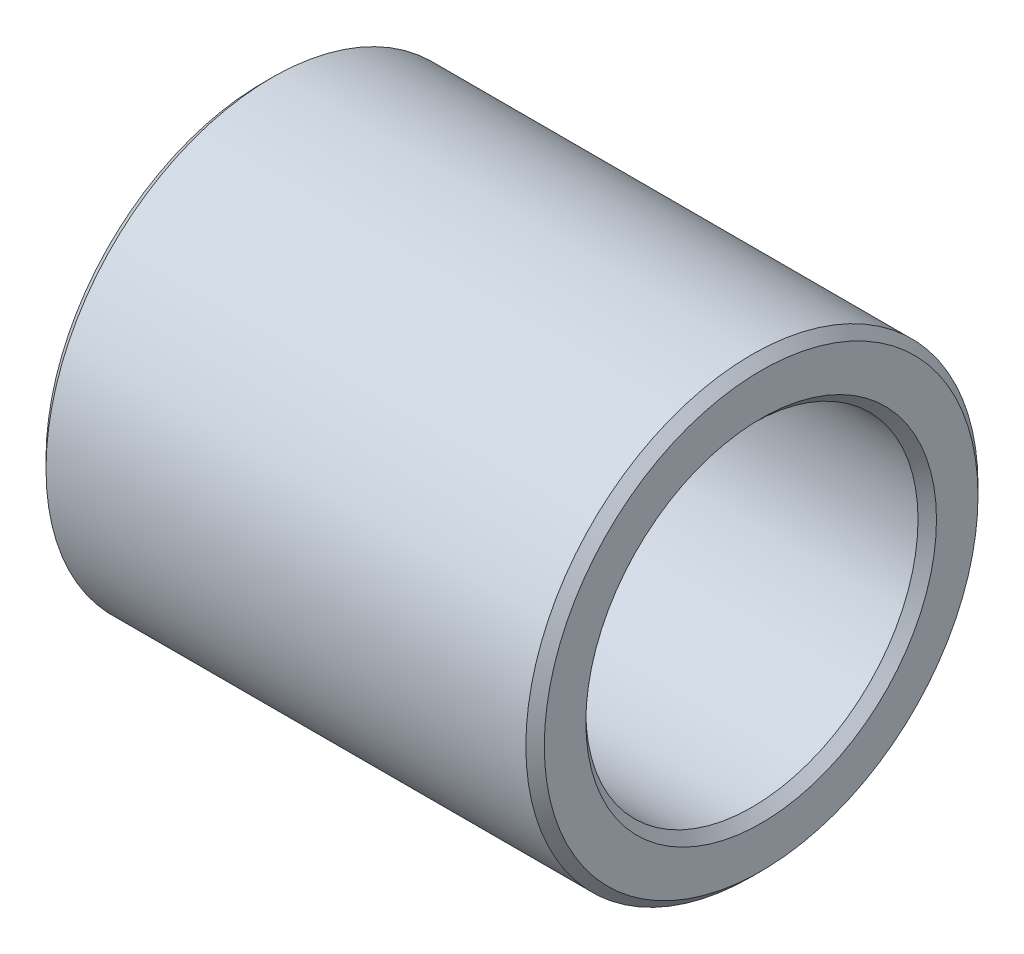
SolidWorks part; units mm, degrees
ref_plane "Plan1" through (0, 0, 0) normal (0, 0, 1) x (1, 0, 0)
ref_plane "Plan2" through (0, 0, 0) normal (0, 1, 0) x (1, 0, 0)
ref_plane "Plan3" through (0, 0, 0) normal (1, 0, 0) x (0, 0, -1)
sketch "Esquisse1" plane through (0, 0, 0) normal (0, 0, 1) x (1, 0, 0)
  line L0 (0, 0) -> (20, 0) construction
  line L1 (-13.5, 12.25) -> (13.5, 12.25)
  point P5 (0, 12.25)
  dimension "D1" = 12.25
  dimension "D2" = 27
revolve "Base-Révol.-Mince" add sketch "Esquisse1" angle 360 about L0
chamfer "Chanfrein1" distance 0.5 angle 45
